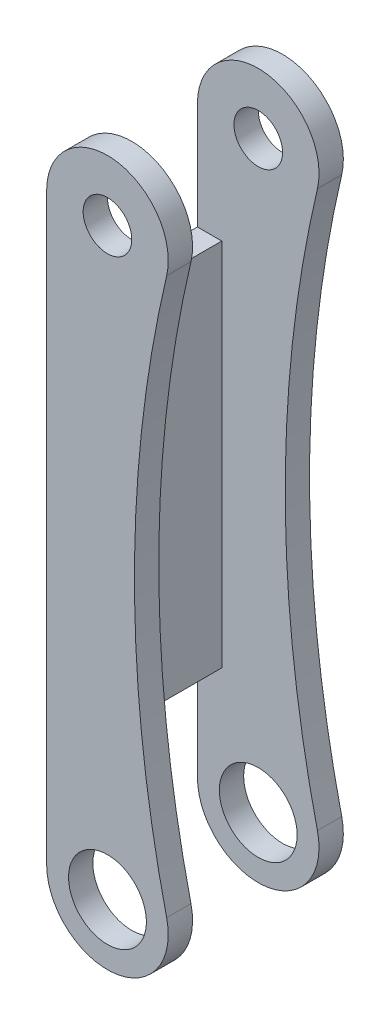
SolidWorks part; units mm, degrees
ref_plane "Front Plane" through (0, 0, 0) normal (0, 0, 1) x (1, 0, 0)
ref_plane "Top Plane" through (0, 0, 0) normal (0, 1, 0) x (1, 0, 0)
ref_plane "Right Plane" through (0, 0, 0) normal (1, 0, 0) x (0, 0, -1)
sketch "Sketch1" plane through (0, 0, 0) normal (0, 0, 1) x (1, 0, 0)
  line L1 (-32.9969, -17.0678) -> (-32.9969, 143.7449) construction
  line L2 (-12.5, 120) -> (-12.5, 0)
  circle A2 centre (0, 0) radius 8
  arc A6 (12.1691, 2.8571) -> (-12.5, 0) centre (0, 0) cw
  arc A7 (12.1691, 117.1429) -> (12.1691, 2.8571) centre (255.5509, 60) ccw
  arc A8 (-12.5, 120) -> (12.1691, 117.1429) centre (0, 120) cw
  circle A9 centre (0, 120) radius 5
  dimension "D1" = 10
  dimension "D2" = 16
  dimension "D3" = 12.5
  dimension "D4" = 250
  dimension "D5" = 120
extrude "Boss-Extrude1" add sketch "Sketch1" along normal blind 36
sketch "Sketch4" plane through (-12.5, 0, 0) normal (1, 0, 0) x (0, -1, 0)
  line L0 (-2.8571, 0) -> (-117.1429, 0) construction
  line L1 (-164.3955, -5) -> (32.5282, -5)
  line L2 (-164.3955, -5) -> (-164.3955, -31)
  line L3 (-164.3955, -31) -> (32.5282, -31)
  line L4 (32.5282, -5) -> (32.5282, -31)
  dimension "D1" = 5
  dimension "D2" = 5
extrude "Cut-Extrude1" cut sketch "Sketch4" along normal through all
sketch "Sketch6" plane through (-12.5, 0, 0) normal (-1, 0, 0) x (0, 0, 1)
  line L0 (5, 0) -> (5, 120) construction
  line L1 (5, 98) -> (31, 98)
  line L2 (5, 98) -> (5, 22)
  line L3 (5, 22) -> (31, 22)
  line L4 (31, 98) -> (31, 22)
  line L5 (31, 120) -> (31, 0) construction
  dimension "D1" = 76
  dimension "D2" = 34.5
extrude "Boss-Extrude2" add sketch "Sketch6" against normal blind 5
